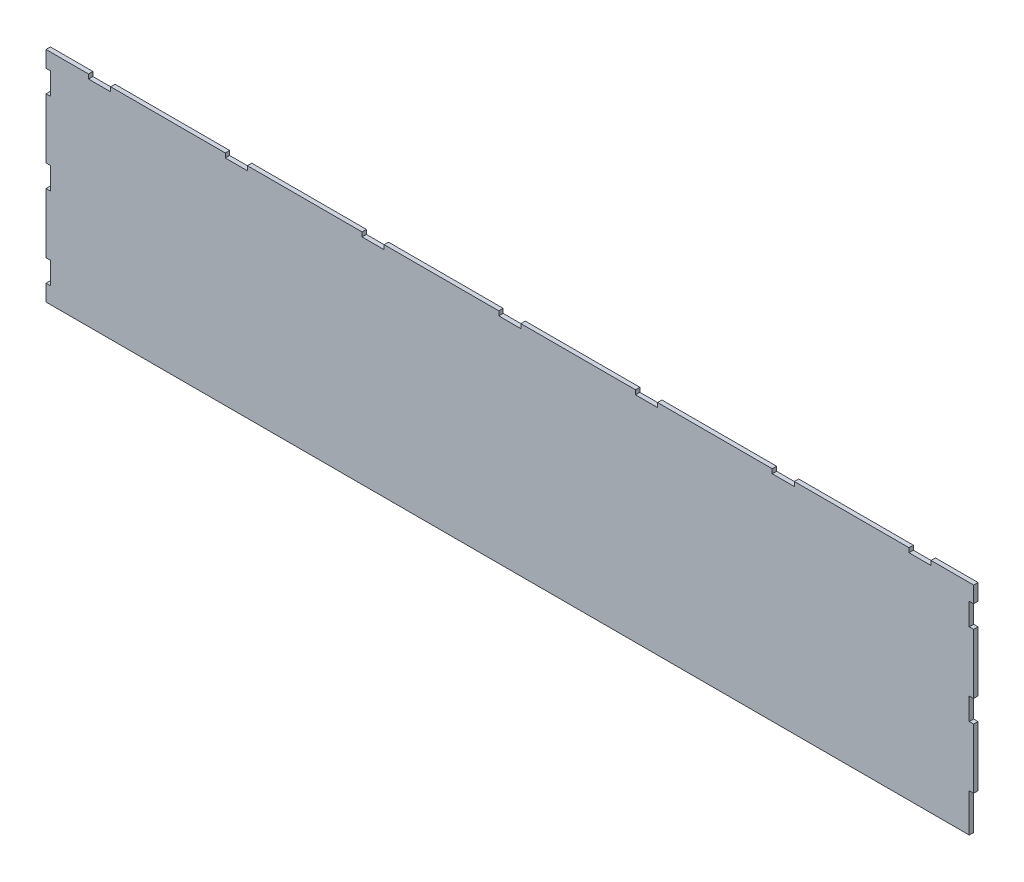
SolidWorks part; units mm, degrees
ref_plane "Ebene vorne" through (0, 0, 0) normal (0, 0, 1) x (1, 0, 0)
ref_plane "Ebene oben" through (0, 0, 0) normal (0, 1, 0) x (1, 0, 0)
ref_plane "Ebene rechts" through (0, 0, 0) normal (1, 0, 0) x (0, 0, -1)
sketch "Skizze1" plane through (0, 0, 0) normal (0, 0, 1) x (1, 0, 0)
  line L1 (-424, -100) -> (424, -100)
  line L2 (-424, -100) -> (-424, 100)
  line L3 (-424, 100) -> (424, 100)
  line L4 (424, -100) -> (424, 100)
  line L5 (-424, -100) -> (424, 100) construction
  line L6 (-424, 100) -> (424, -100) construction
  point P0 (0, 0)
  dimension "D1" = 848
  dimension "D2" = 200
extrude "Aufsatz-Linear austragen1" add sketch "Skizze1" along normal blind 4
sketch "Skizze2" plane through (0, 0, 4) normal (0, 0, 1) x (1, 0, 0)
  line L0 (-424, 100) -> (-424, -100) construction
  line L5 (-424, -85.1) -> (-420, -85.1)
  line L6 (-424, -85.1) -> (-424, -64.9)
  line L7 (-424, -64.9) -> (-420, -64.9)
  line L8 (-420, -85.1) -> (-420, -64.9)
  line L9 (-424, -10.1) -> (-420, -10.1)
  line L10 (-424, -10.1) -> (-424, 10.1)
  line L11 (-424, 10.1) -> (-420, 10.1)
  line L12 (-420, -10.1) -> (-420, 10.1)
  line L13 (424, -100) -> (424, 100) construction
  line L14 (-424, 85.1) -> (-420, 85.1)
  line L15 (-424, 85.1) -> (-424, 64.9)
  line L16 (-424, 64.9) -> (-420, 64.9)
  line L17 (-420, 85.1) -> (-420, 64.9)
  line L18 (424, 85.1) -> (420, 85.1)
  line L19 (424, 85.1) -> (424, 64.9)
  line L20 (424, 64.9) -> (420, 64.9)
  line L21 (420, 85.1) -> (420, 64.9)
  line L22 (-424, -100) -> (424, -100) construction
  line L23 (424, 10.1) -> (420, 10.1)
  line L24 (424, 10.1) -> (424, -10.1)
  line L25 (424, -10.1) -> (420, -10.1)
  line L26 (420, 10.1) -> (420, -10.1)
  line L27 (424, -64.9) -> (420, -64.9)
  line L28 (424, -64.9) -> (424, -100)
  line L29 (424, -100) -> (420, -100)
  line L30 (420, -64.9) -> (420, -100)
  line L31 (424, 100) -> (-424, 100) construction
  line L32 (0, 0) -> (0, 96) construction
  line L33 (-385.1, 100) -> (-364.9, 100)
  line L34 (-385.1, 100) -> (-385.1, 96)
  line L35 (-385.1, 96) -> (-364.9, 96)
  line L36 (-364.9, 100) -> (-364.9, 96)
  line L37 (-260.1, 100) -> (-239.9, 100)
  line L38 (-260.1, 100) -> (-260.1, 96)
  line L39 (-260.1, 96) -> (-239.9, 96)
  line L40 (-239.9, 100) -> (-239.9, 96)
  line L41 (-135.1, 100) -> (-114.9, 100)
  line L42 (-135.1, 100) -> (-135.1, 96)
  line L43 (-135.1, 96) -> (-114.9, 96)
  line L44 (-114.9, 100) -> (-114.9, 96)
  line L45 (-10.1, 100) -> (10.1, 100)
  line L46 (-10.1, 100) -> (-10.1, 96)
  line L47 (-10.1, 96) -> (10.1, 96)
  line L48 (10.1, 100) -> (10.1, 96)
  line L49 (114.9, 100) -> (135.1, 100)
  line L50 (114.9, 100) -> (114.9, 96)
  line L51 (114.9, 96) -> (135.1, 96)
  line L52 (135.1, 100) -> (135.1, 96)
  line L53 (239.9, 100) -> (260.1, 100)
  line L54 (239.9, 100) -> (239.9, 96)
  line L55 (239.9, 96) -> (260.1, 96)
  line L56 (260.1, 100) -> (260.1, 96)
  line L57 (364.9, 100) -> (385.1, 100)
  line L58 (364.9, 100) -> (364.9, 96)
  line L59 (364.9, 96) -> (385.1, 96)
  line L60 (385.1, 100) -> (385.1, 96)
  line L61 (-420, 0) -> (0, 0) construction
  point P3 (0, 100)
  point P36 (-424, 75)
  point P68 (-125, 100)
  point P70 (-250, 100)
  point P71 (-375, 100)
  point P72 (125, 100)
  point P75 (250, 100)
  point P76 (375, 100)
  point P83 (-424, 0)
  point P84 (-424, -75)
  dimension "D1" = 20.2
  dimension "D2" = 75
  dimension "D3" = 75
  dimension "D4" = 125
  dimension "D5" = 125
  dimension "D6" = 125
  dimension "D7" = 20.2
  dimension "D8" = 125
  dimension "D9" = 125
  dimension "D10" = 125
  dimension "D11" = 4
extrude "Schnitt-Linear austragen1" cut sketch "Skizze2" against normal through all
